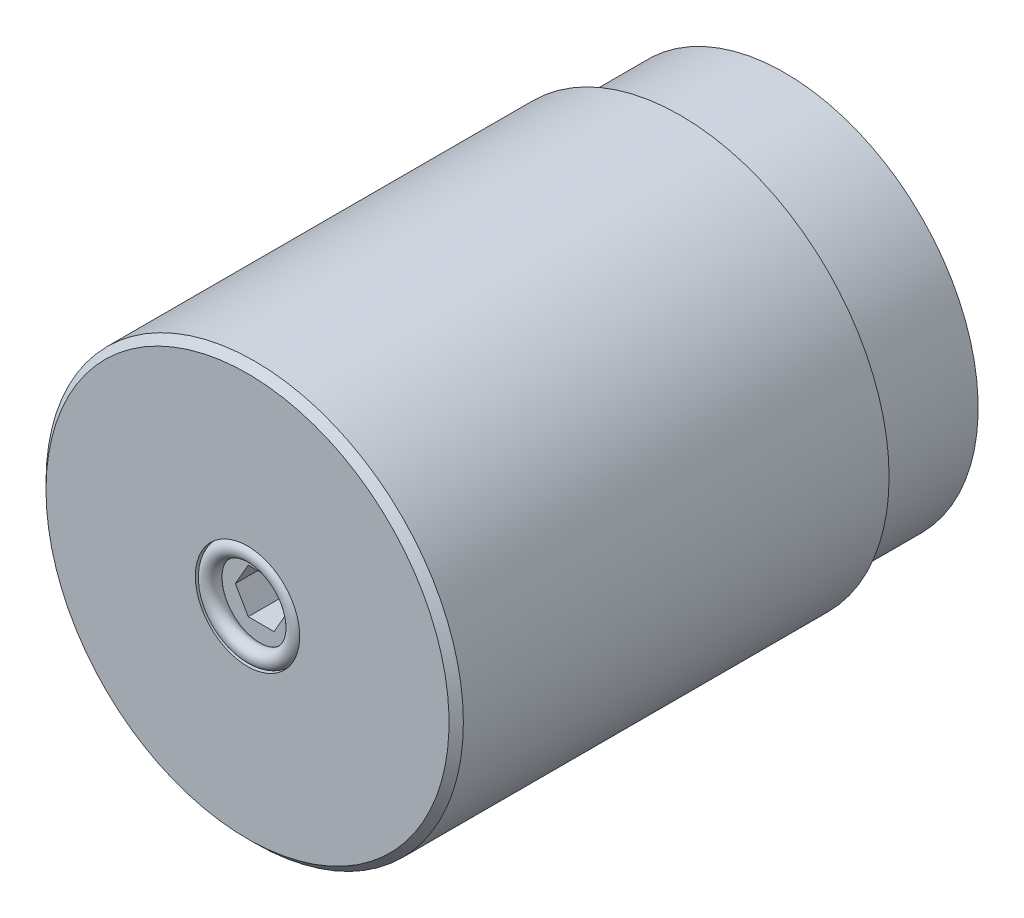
SolidWorks part; units mm, degrees
ref_plane "Front Plane" through (0, 0, 0) normal (0, 0, 1) x (1, 0, 0)
ref_plane "Top Plane" through (0, 0, 0) normal (0, 1, 0) x (1, 0, 0)
ref_plane "Right Plane" through (0, 0, 0) normal (1, 0, 0) x (0, 0, -1)
sketch "Sketch1" plane through (0, 0, 0) normal (1, 0, 0) x (0, 0, -1)
  line L0 (0, 0) -> (-33.2863, 0) construction
  line L1 (1.4478, 0) -> (1.4478, 5.5499)
  line L2 (1.4478, 5.5499) -> (0, 5.5499)
  line L3 (0, 5.5499) -> (0, 22.1996)
  line L4 (0, 22.1996) -> (46.0502, 22.1996)
  line L5 (46.0502, 22.1996) -> (46.0502, 20.574)
  line L6 (46.0502, 20.574) -> (57.15, 20.574)
  line L7 (57.15, 20.574) -> (57.15, 0)
  line L8 (57.15, 0) -> (1.4478, 0)
  dimension "D1" = 44.3992
  dimension "D2" = 41.148
  dimension "D3" = 11.0998
  dimension "D4" = 57.15
  dimension "D5" = 1.4478
  dimension "D6" = 11.0998
revolve "Revolve1" add sketch "Sketch1" angle 360 about L0
fillet "Fillet1" radius 0.381 1 edges at (-20.574, 0, -46.0502)
sketch "Sketch2" plane through (0, 0, -1.4478) normal (0, 0, 1) x (1, 0, 0)
  line L1 (2.7423, 0) -> (1.3711, 2.3749)
  line L2 (1.3711, 2.3749) -> (-1.3711, 2.3749)
  line L3 (-1.3711, 2.3749) -> (-2.7423, 0)
  line L4 (-2.7423, 0) -> (-1.3711, -2.3749)
  line L5 (-1.3711, -2.3749) -> (1.3711, -2.3749)
  line L6 (1.3711, -2.3749) -> (2.7423, 0)
  circle A0 centre (0, 0) radius 2.3749 construction
  dimension "D1" = 4.7498
extrude "Cut-Extrude1" cut sketch "Sketch2" against normal blind 6.9342
sketch "Sketch3" plane through (0, 0, 0) normal (1, 0, 0) x (0, 0, -1)
  line L0 (0, 0) -> (19.0797, 0) construction
  line L1 (1.4478, 5.5499) -> (1.4478, -5.5499) construction
  line L2 (1.4478, 5.1175) -> (1.4478, 4.2017)
  arc A0 (1.4478, 5.1175) -> (1.4478, 4.2017) centre (0.6858, 4.6596) ccw
  dimension "D1" = 0.762
  dimension "D2" = 0.889
  dimension "D3" = 9.3193
revolve "Revolve4" add sketch "Sketch3" angle 360 about L0
chamfer "Chamfer1" distance 0.762 angle 45 1 edges at (-22.1996, 0, 0)
hole_wizard "1/8 (0.125) Diameter Hole1" positions "Sketch5" profile "Sketch4" hole size "1/8" standard "Ansi Inch"
sketch "Sketch5" plane through (0, 0, -57.15) normal (0, 0, -1) x (-1, 0, 0)
  line L0 (0, 0) -> (-25.7422, 0) construction
  circle A0 centre (0, 0) radius 15.875 construction
  point P0 (-15.875, 0)
  dimension "D1" = 31.75
sketch "Sketch4" plane through (15.875, 0, -57.15) normal (1, 0, 0) x (0, 1, 0)
  line L0 (0, 0) -> (0, 4.2559)
  line L1 (0, 4.2559) -> (1.5875, 3.302)
  line L2 (1.5875, 3.302) -> (1.5875, 0)
  line L5 (1.5875, 0) -> (0, 0)
  line L10 (0, 4.2559) -> (-1.5875, 3.302) construction
  line L11 (0, -6.35) -> (0, 107.95) construction
  dimension "Hole Dia." = 3.175
  dimension "Hole Depth" = 3.302
  dimension "Drill Angle" = 118
pattern_circular "CirPattern1" count 4 every 60 about axis through (0, 0, 0) along (0, 0, 1) of "1/8 (0.125) Diameter Hole1"
sketch "Sketch6" plane through (0, 0, 0) normal (1, 0, 0) x (0, 0, -1)
  line L0 (0, 0) -> (60.7251, 0) construction
  line L1 (59.4339, 4.445) -> (34.5256, 4.445) construction
  line L2 (57.15, 12.7) -> (54.2819, 12.7)
  line L3 (57.15, -20.574) -> (57.15, 20.574) construction
  line L4 (49.9872, 13.959) -> (49.9872, 4.445)
  line L5 (57.15, 12.7) -> (57.15, 4.445)
  line L6 (57.15, 4.445) -> (49.9872, 4.445)
  arc A0 (54.2819, 12.7) -> (49.9872, 13.959) centre (49.53, 4.445) ccw
  dimension "D2" = 9.525
  dimension "D3" = 0.4572
  dimension "D1" = 4.445
  dimension "D4" = 7.1628
  dimension "D5" = 16.51
revolve "Cut-Revolve1" cut sketch "Sketch6" angle 360 about L1
fillet "Fillet2" radius 1.6002 1 edges at (0, 12.7, -57.15)
